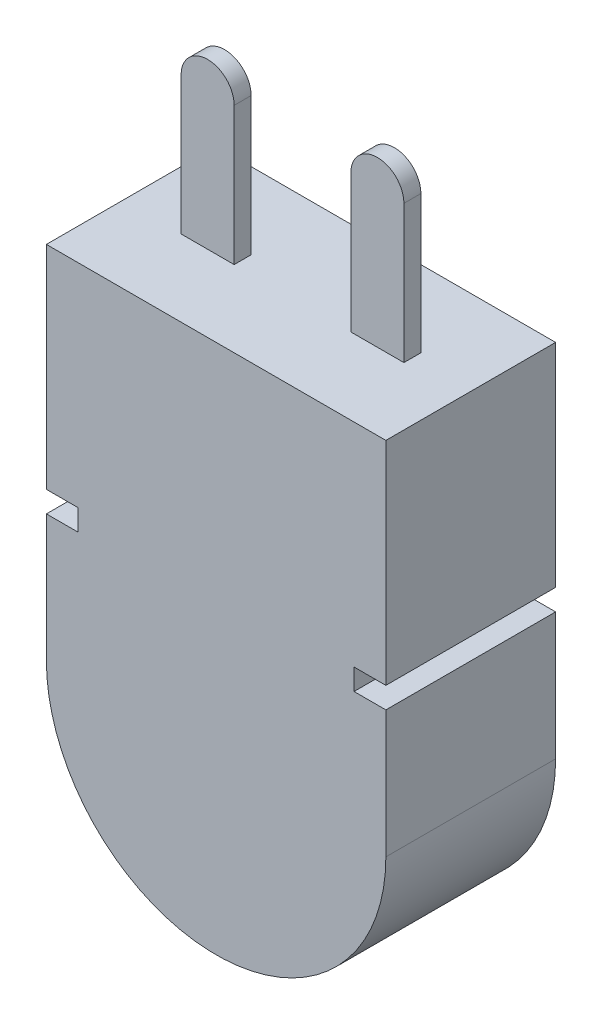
SolidWorks part; units mm, degrees
ref_plane "Front Plane" through (0, 0, 0) normal (0, 0, 1) x (1, 0, 0)
ref_plane "Top Plane" through (0, 0, 0) normal (0, 1, 0) x (1, 0, 0)
ref_plane "Right Plane" through (0, 0, 0) normal (1, 0, 0) x (0, 0, -1)
sketch "Sketch2" plane through (0, 0, 0) normal (0, 0, 1) x (1, 0, 0)
  line L0 (-8, 0) -> (8, 0)
  line L1 (8, 0) -> (8, -10)
  line L2 (8, -10) -> (6.5, -10)
  line L3 (6.5, -10) -> (6.5, -11)
  line L4 (6.5, -11) -> (8, -11)
  line L5 (8, -11) -> (8, -17)
  line L6 (-8, -17) -> (-8, -11)
  line L7 (-8, -11) -> (-6.5, -11)
  line L8 (-6.5, -11) -> (-6.5, -10)
  line L9 (-6.5, -10) -> (-8, -10)
  line L10 (-8, -10) -> (-8, 0)
  arc A0 (8, -17) -> (-8, -17) centre (0, -17) cw
  point P4 (0, 0)
  point P12 (0, -25)
  point P17 (-6.5, -8.7168)
  dimension "D1" = 25
  dimension "D2" = 16
  dimension "D3" = 1.5
  dimension "D4" = 1
  dimension "D5" = 10
extrude "Boss-Extrude1" add sketch "Sketch2" along normal mid plane 8
sketch "Sketch3" plane through (0, 0, 0) normal (0, 0, 1) x (1, 0, 0)
  line L0 (-5.25, 0) -> (-5.25, 6.5)
  line L1 (8, 0) -> (-8, 0) construction
  line L2 (-2.75, 6.5) -> (-2.75, 0)
  line L3 (-5.25, 0) -> (-2.75, 0)
  line L4 (0, -4.4) -> (0, 4.4) construction
  line L5 (5.25, 0) -> (5.25, 6.5)
  line L6 (2.75, 6.5) -> (2.75, 0)
  line L7 (5.25, 0) -> (2.75, 0)
  arc A0 (-5.25, 6.5) -> (-2.75, 6.5) centre (-4, 6.5) cw
  arc A1 (5.25, 6.5) -> (2.75, 6.5) centre (4, 6.5) ccw
  point P6 (-4, 0)
  dimension "D1" = 2.5
  dimension "D2" = 6.5
  dimension "D3" = 4
extrude "Boss-Extrude2" add sketch "Sketch3" along normal mid plane 0.8
